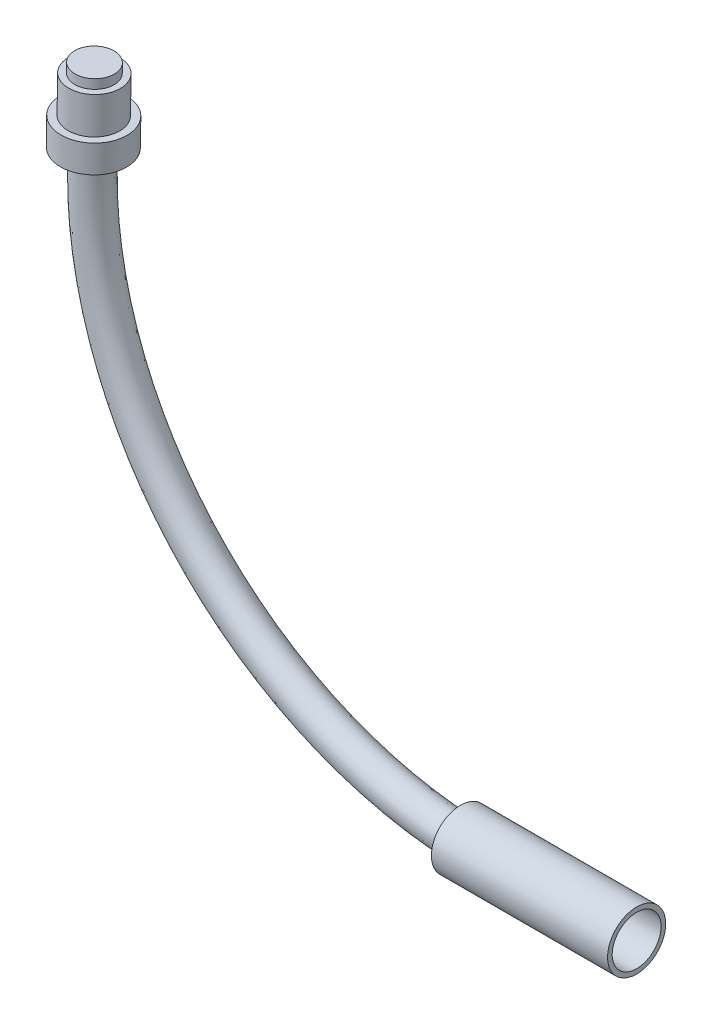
SolidWorks part; units mm, degrees
ref_plane "Plan1" through (0, 0, 0) normal (0, 0, 1) x (1, 0, 0)
ref_plane "Plan2" through (0, 0, 0) normal (0, 1, 0) x (1, 0, 0)
ref_plane "Plan3" through (0, 0, 0) normal (1, 0, 0) x (0, 0, -1)
sketch "Esquisse1" plane through (0, 0, 0) normal (0, 0, 1) x (1, 0, 0)
  line L0 (44.7803, 249.8848) -> (44.7803, 262.4305)
  line L1 (44.7803, 256.1576) -> (6.2122, 256.1576) construction
  line L2 (-72.9723, 368.4528) -> (-72.9723, 345.7166) construction
  line L3 (6.2122, 256.1576) -> (6.2122, 291.3172) construction
  line L101 (6.2122, 252.3722) -> (6.075, 249.8848)
  line L102 (6.075, 249.8848) -> (44.7803, 249.8848)
  line L103 (44.7803, 249.8848) -> (44.7803, 262.4305)
  line L104 (44.7803, 262.4305) -> (6.2308, 262.4305)
  line L105 (6.2308, 262.4305) -> (6.2308, 259.8578)
  line L106 (-69.0809, 345.7681) -> (-65.1403, 345.5081)
  line L107 (-65.1403, 345.5081) -> (-64.7676, 351.1565)
  line L108 (-64.7676, 351.1565) -> (-66.3762, 351.2626)
  line L109 (-66.3762, 351.2626) -> (-65.8721, 358.9033)
  line L110 (-77.4066, 345.7166) -> (-80.1555, 345.7166)
  line L111 (-80.1555, 345.7166) -> (-80.1555, 351.6899)
  line L112 (-80.1555, 351.6899) -> (-78.4794, 351.6899)
  line L113 (-78.4794, 351.6899) -> (-78.4794, 359.735)
  line L114 (-78.4794, 359.735) -> (-65.8721, 358.9033)
  line L115 (-78.2698, 362.5048) -> (-65.6817, 361.7901)
  line L116 (-65.6817, 361.7901) -> (-67.92, 368.4528)
  line L117 (-78.2698, 362.5048) -> (-75.6299, 368.4528)
  line L118 (-75.6299, 368.4528) -> (-67.92, 368.4528)
  arc A0 (-72.9723, 345.7166) -> (6.2122, 256.1576) centre (11.3994, 340.5294) ccw
  arc A33 (-69.0809, 345.7681) -> (6.2308, 259.8578) centre (11.5104, 340.4516) ccw
  arc A34 (-77.4066, 345.7166) -> (6.2122, 252.3722) centre (11.0912, 340.8683) ccw
  arc A35 (-65.8721, 358.9033) -> (-65.6817, 361.7901) centre (-65.571, 360.3331) cw
  arc A36 (-78.4794, 359.735) -> (-78.2698, 362.5048) centre (-78.8945, 361.1593) ccw
ref_plane "Plan5" through (6.2122, 0, 0) normal (1, 0, 0) x (0, 0, -1)
sketch "Esquisse2" plane through (6.2122, 0, 0) normal (1, 0, 0) x (0, 0, -1)
  circle A0 centre (0, 256.1576) radius 3.7855
sketch "Esquisse7" plane through (0, 0, 0) normal (0, 0, 1) x (1, 0, 0)
  arc A0 (6.2122, 256.1576) -> (-72.9723, 345.7166) centre (10.6822, 339.8952) cw
sweep "Base-Balayage" add profiles "Esquisse2" path "Esquisse7"
sketch "Esquisse8" plane through (6.2122, 0, 0) normal (1, 0, 0) x (0, 0, -1)
  circle A0 centre (0, 256.1576) radius 6.2729
extrude "Boss.-Extru.1" add sketch "Esquisse8" along normal blind 38
sketch "Esquisse9" plane through (5.5621, 344.4485, 0) normal (0.0161, 0.9999, 0) x (-0.9999, 0.0161, 0)
  circle A0 centre (78.5447, 0) radius 7.1822
extrude "Boss.-Extru.2" add sketch "Esquisse9" along normal blind 6
sketch "Esquisse10" plane through (5.659, 350.4477, 0) normal (0.0161, 0.9999, 0) x (-0.9999, 0.0161, 0)
  circle A0 centre (78.5447, 0) radius 5.6028
extrude "Boss.-Extru.3" add sketch "Esquisse10" along normal blind 8
sketch "Esquisse11" plane through (5.7881, 358.4467, 0) normal (0.0161, 0.9999, 0) x (-0.9999, 0.0161, 0)
  circle A0 centre (78.5447, 0) radius 4.2599
extrude "Boss.-Extru.4" add sketch "Esquisse11" along normal blind 2
shell "Coque1" thickness 1
scale "Echelle1"
scale "Echelle2"
scale "Echelle4"
